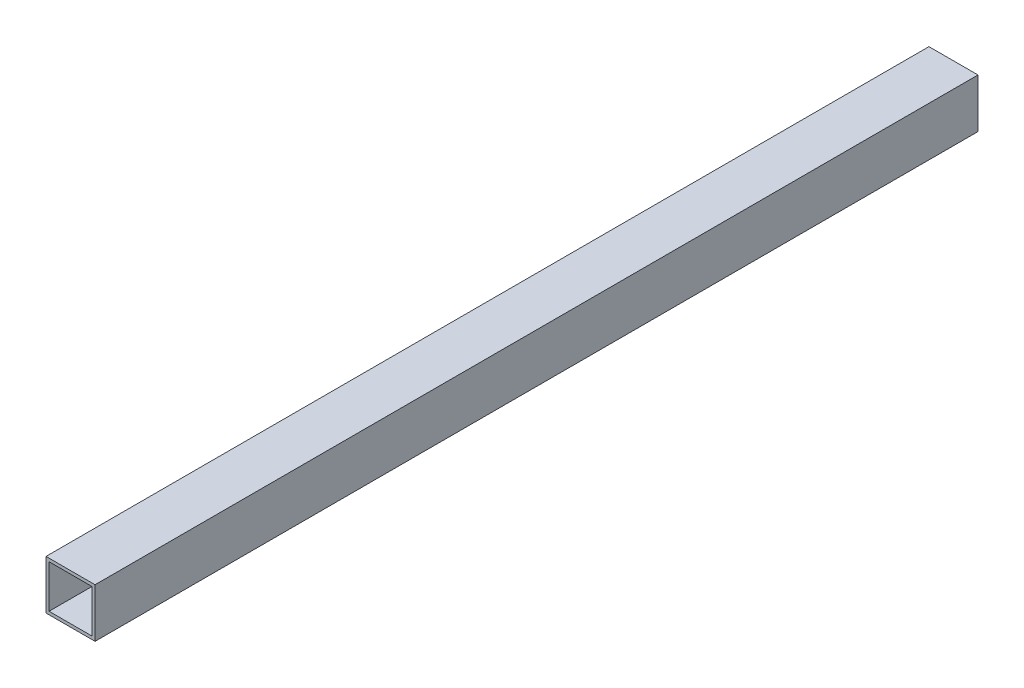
SolidWorks part; units mm, degrees
ref_plane "Plane1" through (0, 0, 0) normal (0, 0, 1) x (1, 0, 0)
ref_plane "Plane2" through (0, 0, 0) normal (0, 1, 0) x (1, 0, 0)
ref_plane "Plane3" through (0, 0, 0) normal (1, 0, 0) x (0, 0, -1)
sketch "Sketch1" plane through (0, 0, 0) normal (0, 0, 1) x (1, 0, 0)
  line L0 (1.5875, 1.5875) -> (23.8125, 1.5875)
  line L1 (0, 0) -> (25.4, 0)
  line L2 (0, 0) -> (0, 25.4)
  line L3 (0, 25.4) -> (25.4, 25.4)
  line L4 (25.4, 0) -> (25.4, 25.4)
  line L5 (23.8125, 1.5875) -> (23.8125, 23.8125)
  line L6 (1.5875, 23.8125) -> (23.8125, 23.8125)
  line L7 (1.5875, 1.5875) -> (1.5875, 23.8125)
  dimension "D1" = 25.4
  dimension "D2" = 25.4
  dimension "D3" = 1.5875
extrude "Base-Extrude" add sketch "Sketch1" along normal blind 457.2
